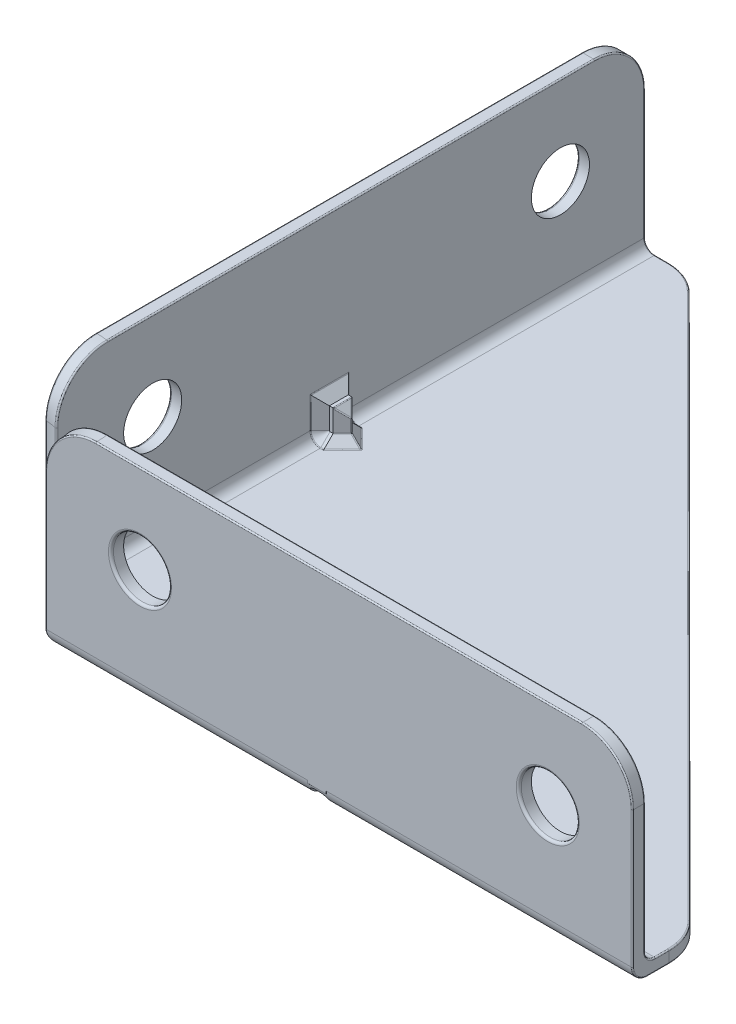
SolidWorks part; units mm, degrees
ref_plane "Front Plane" through (0, 0, 0) normal (0, 0, 1) x (1, 0, 0)
ref_plane "Top Plane" through (0, 0, 0) normal (0, 1, 0) x (1, 0, 0)
ref_plane "Right Plane" through (0, 0, 0) normal (1, 0, 0) x (0, 0, -1)
sketch "Sketch1" plane through (0, 0, 0) normal (0, 1, 0) x (1, 0, 0)
  line L0 (0, 0) -> (50, 50) construction
  line L1 (0, 0) -> (50, 0) construction
  line L2 (0, 0) -> (0, 50) construction
  line L3 (0, 50) -> (50, 50) construction
  line L4 (50, 0) -> (50, 50) construction
  line L5 (3.5, 0) -> (50, 0)
  line L6 (50, 0) -> (50, 4.5598)
  line L7 (0, 3.5) -> (0, 50)
  line L8 (0, 50) -> (4.5, 50)
  line L9 (4.5, 50) -> (50, 4.5598)
  arc A0 (0, 3.5) -> (3.5, 0) centre (0, 0) cw
  circle A1 centre (15.3, 15.3) radius 3.1
extrude "Boss-Extrude1" add sketch "Sketch1" along normal blind 16 contours L7 L8 L9 L6 L5 A0
sketch "Sketch2" plane through (0, 16, 0) normal (0, 1, 0) x (1, 0, 0)
  line L0 (1, 50) -> (4.5, 50)
  line L1 (0, 50) -> (1, 50) construction
  line L2 (0, 50) -> (0, 3) construction
  line L5 (50, 0) -> (3.5, 0)
  line L6 (50, 0) -> (50, 1) construction
  line L9 (4.5, 50) -> (50, 4.5598)
  line L10 (50, 4.5598) -> (50, 1)
  line L14 (3.349, 1) -> (50, 1)
  line L15 (0, 50) -> (1, 50) construction
  line L16 (0, 50) -> (0, 0) construction
  line L17 (0, 0) -> (1, 0) construction
  line L18 (1, 50) -> (1, 0) construction
  line L19 (0, 0) -> (50, 0) construction
  line L20 (0, 0) -> (0, 1) construction
  line L21 (0, 1) -> (50, 1) construction
  line L22 (50, 0) -> (50, 1) construction
  line L23 (1, 3.349) -> (1, 50)
  arc A0 (0, 3.5) -> (3.5, 0) centre (0, 0) cw construction
  arc A2 (1, 3.349) -> (3.349, 1) centre (0, 0) cw
extrude "Cut-Extrude1" cut sketch "Sketch2" against normal blind 15
fillet "Fillet1" radius 0.8 2 edges at (26.6771, 1, -1) (1, 1, -26.6771)
fillet "Fillet2" radius 1.2 3 edges at (0, 0, -26.75) (26.75, 0, 0) (2.4749, 0, -2.4749)
fillet "Fillet3" radius 4 1 edges at (0.5, 16, -50)
fillet "Fillet4" radius 4 1 edges at (50, 16, -0.5)
fillet "Fillet5" radius 4 2 edges at (3.4633, 16, -0.5053) (0.5053, 16, -3.4633)
sketch "Sketch3"
sketch_block_instance "Block2-1"
sketch_block "Block2"
extrude "Cut-Extrude2" cut sketch "Sketch3" against normal blind 20
sketch "Sketch4" plane through (0, 0, -1) normal (0, 0, -1) x (-1, 0, 0)
  circle B0 centre (-11, 9) radius 2.3
  circle B1 centre (-43.3, 9) radius 2.3
sketch_block_instance "Block2-6"
extrude "Cut-Extrude3" cut sketch "Sketch4" against normal blind 20
fillet "Fillet6" radius 4 2 edges at (50, 0.5, -4.5598) (4.5, 0.5, -50)
fillet "Fillet7" radius 0.2 4 edges at (0, 9, -41) (0, 9, -8.7) (8.7, 9, 0) (41, 9, 0)
sketch "Sketch5" plane through (0, 1, 0) normal (0, 1, 0) x (1, 0, 0)
  line B0 (0, 0) -> (0, 25) construction
  line B1 (0, 25) -> (0, 26.2) construction
  line B2 (0, 25) -> (0, 23.8) construction
  line B3 (0, 24.25) -> (0, 25.75)
  line B4 (0, 0) -> (25, 0) construction
  line B5 (0, 24.25) -> (0, 25.75)
  line B6 (0, 24.25) -> (2.8, 24.25)
  line B7 (2.8, 24.25) -> (2.8, 25.75)
  line B8 (0, 25.75) -> (2.8, 25.75)
  line B9 (25, 0) -> (26.2, 0) construction
  line B10 (25, 0) -> (23.8, 0) construction
  line B11 (24.25, 0) -> (25.75, 0)
  line B12 (24.25, 0) -> (24.25, 2.8)
  line B13 (24.25, 0) -> (25.75, 0)
  line B14 (25.75, 0) -> (25.75, 2.8)
  line B15 (24.25, 2.8) -> (25.75, 2.8)
sketch_block_instance "Block4-2"
sketch_block "Block4"
sketch "Sketch7"
sketch_block_instance "Block4-1"
extrude "Boss-Extrude3" add sketch "Sketch5" along normal blind 2.5
extrude "Cut-Extrude6" cut sketch "Sketch7" against normal blind 0.8
chamfer "Chamfer4" distance 0.75 angle 45 22 edges at (2.8, 2.25, -24.25) (2.8, 1, -25) (2.8, 3.5, -25) (2.8, 2.25, -25.75) (1, 2.65, -24.25) (1, 3.5, -25) (1, 2.65, -25.75) (24.25, 2.65, -1) (24.25, 1.2343, -1.2343) (24.25, 1, -2.3) (25.75, 1, -2.3) (25.75, 1.2343, -1.2343) (25, 3.5, -1) (25.75, 2.65, -1) (24.25, 2.25, -2.8) (25, 1, -2.8) (25, 3.5, -2.8) (25.75, 2.25, -2.8) (2.3, 1, -24.25) (2.3, 1, -25.75) (1.2343, 1.2343, -24.25) (1.2343, 1.2343, -25.75)
fillet "Fillet14" radius 0.5 6 edges at (1.4343, 0.8, -24.25) (2.8, 0.8, -25) (1.4343, 0.8, -25.75) (25, 0.8, -2.8) (25.75, 0.8, -1.4343) (24.25, 0.8, -1.4343)
fillet "Fillet16" radius 0.1 41 edges at (3.6554, 0.6033, -0.1589) (3.5, 6.6, 0) (4.6716, 14.8284, 0) (0.1589, 0.6033, -3.6554) (0, 6.6, -3.5) (0, 14.8284, -4.6716) (0, 16, -26.75) (0, 14.8284, -48.8284) (0, 6.6, -50) (0.3515, 0.3515, -50) (2.0223, 0, -50) (4.3742, 0, -49.696) (27.2489, 0, -27.281) (49.695, 0, -4.4334) (50, 0, -2.0507) (50, 0.3515, -0.3515) (50, 6.6, 0) (48.8284, 14.8284, 0) (1, 15.1014, -4.8723) (1, 6.9, -3.3541) (1.0968, 1.4185, -3.3237) (1.505, 1.0564, -3.1695) (2.4867, 1, -2.4867) (3.1556, 1.0444, -1.5373) (3.3414, 1.5454, -1.0416) (3.3541, 6.9, -1) (4.207, 14.4319, -1) (26.7165, 16, -1) (48.8284, 14.8284, -1) (50, 6.9, -1) (50, 1.2343, -1.2343) (50, 1, -2.3507) (49.695, 1, -4.4334) (27.2489, 1, -27.281) (4.3742, 1, -49.696) (2.3223, 1, -50) (1.2343, 1.2343, -50) (1, 6.9, -50) (1, 14.8284, -48.8284) (26.75, 16, 0) (1, 16, -26.7165)
fillet "Fillet19" radius 0.1 33 edges at (26.5, 1, -1.925) (26.125, 1, -2.425) (25.375, 1, -3.175) (24.625, 1, -3.175) (23.875, 1, -2.425) (23.5, 1, -1.925) (1.925, 1, -23.5) (2.425, 1, -23.875) (3.175, 1, -24.625) (3.175, 1, -25.375) (2.425, 1, -26.125) (1.925, 1, -26.5) (2.05, 3.5, -25) (1.2343, 1.2343, -23.5) (1.2343, 1.2343, -26.5) (1, 3.025, -26.5) (1, 4.25, -25) (1, 3.025, -23.5) (26.5, 3.025, -1) (25, 4.25, -1) (23.5, 3.025, -1) (23.5, 1.2343, -1.2343) (26.5, 1.2343, -1.2343) (2.425, 3.125, -24.625) (2.8, 2.25, -25) (2.425, 3.125, -25.375) (2.425, 1.75, -24.625) (2.425, 1.75, -25.375) (3.175, 1.375, -25) (25.375, 1.75, -2.425) (25.375, 3.125, -2.425) (24.625, 3.125, -2.425) (24.625, 1.75, -2.425)
fillet "Fillet20" radius 0.1 5 edges at (25, 1.3832, -3.1668) (25, 2.2305, -2.8) (25, 1.0112, -3.5582) (25, 2.75, -2.7811) (25, 1.7515, -2.8066)
sketch "Sketch8" plane through (0, 1, 0) normal (0, 1, 0) x (1, 0, 0)
  line L0 (48.7559, 5.661) -> (5.6006, 48.7595) construction
  circle A0 centre (27.1782, 27.2102) radius 20
  dimension "D1" = 40
